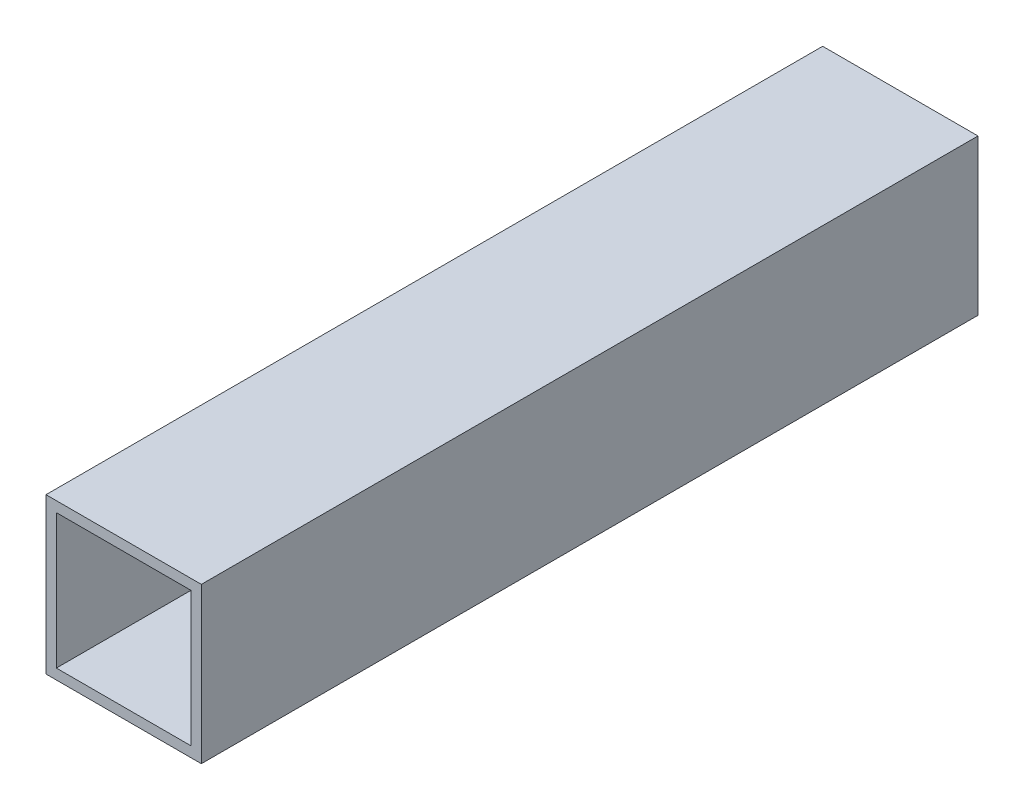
SolidWorks part; units mm, degrees
ref_plane "Plan de face" through (0, 0, 0) normal (0, 0, 1) x (1, 0, 0)
ref_plane "Plan de dessus" through (0, 0, 0) normal (0, 1, 0) x (1, 0, 0)
ref_plane "Plan de droite" through (0, 0, 0) normal (1, 0, 0) x (0, 0, -1)
sketch "Esquisse1" plane through (0, 0, 0) normal (0, 0, 1) x (1, 0, 0)
  line L0 (-32.7851, 0) -> (47.4143, 0) construction
  line L1 (-15, 15) -> (15, 15)
  line L2 (-15, 15) -> (-15, -15)
  line L3 (-15, -15) -> (15, -15)
  line L4 (15, 15) -> (15, -15)
  line L5 (0, 21.8132) -> (0, -24.1643) construction
  dimension "D1" = 30
  dimension "D2" = 30
extrude "Extru.-Mince1" add sketch "Esquisse1" along normal blind 150 thin
